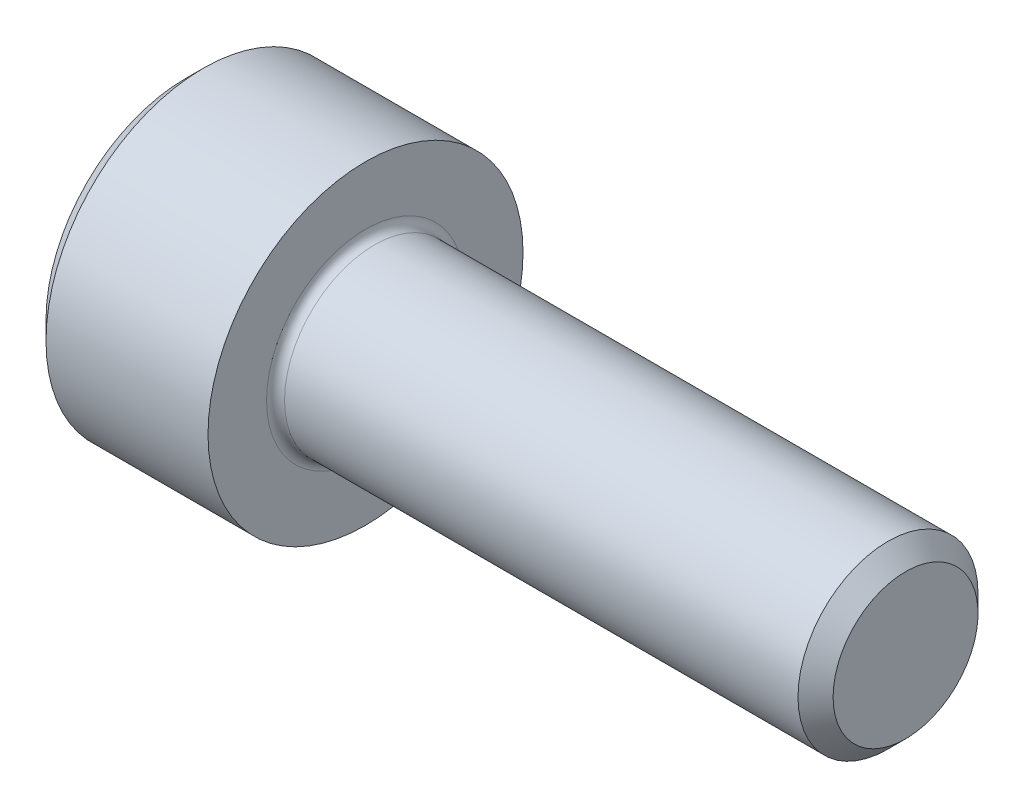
SolidWorks part; units mm, degrees
ref_plane "Plane1" through (0, 0, 0) normal (0, 0, 1) x (1, 0, 0)
ref_plane "Plane2" through (0, 0, 0) normal (0, 1, 0) x (1, 0, 0)
ref_plane "Plane3" through (0, 0, 0) normal (1, 0, 0) x (0, 0, -1)
sketch "BodySke" plane through (0, 0, 0) normal (0, 0, 1) x (1, 0, 0)
  line L0 (0, 0) -> (0, 3.1)
  line L1 (0.4, 3.5) -> (4, 3.5)
  line L2 (4, 3.5) -> (4, 2)
  line L3 (4, 2) -> (15.61, 2)
  line L4 (16, 1.61) -> (16, 0)
  line L5 (16, 0) -> (0, 0)
  line L6 (-31.75, 0) -> (127, 0) construction
  line L7 (0, 3.1) -> (0.4, 3.5)
  line L8 (16, 1.61) -> (15.61, 2)
  line L9 (0, -3.1) -> (0.4, -3.5) construction
  line L10 (16, -1.61) -> (15.61, -2) construction
  line L11 (4.7, 9.525) -> (4.7, 3.175) construction
  line L12 (4, 9.525) -> (4, 3.175) construction
  line L13 (-34, 9.525) -> (-34, 3.175) construction
  dimension "Diameter" = 4
  dimension "Head_ht" = 4
  dimension "Length" = 12
  dimension "Body_ch_ang" = 45
  dimension "Head_dia" = 7
  dimension "Head_ch_ang" = 45
  dimension "Minor_dia" = 3.22
  dimension "Advance" = 0.7
  dimension "Thread_nom" = 12
  dimension "Thread_length" = 50
  dimension "Head_ch_ht" = 0.4
revolve "Base-Revolve" add sketch "BodySke"
fillet "Fillet1" radius 0.2 1 edges at (4, 0, 2)
sketch "Sketch2" plane through (0, 0, 0) normal (0, 0, 1) x (1, 0, 0)
  line L0 (0, 1.5355) -> (2, 1.5355)
  line L1 (2, 1.5355) -> (2.8865, 0)
  line L2 (-31.75, 0) -> (127, 0) construction
  line L3 (2.8865, 0) -> (0, 0)
  line L4 (0, 0) -> (0, 1.5355)
  line L5 (0, 3.1) -> (0, -3.1) construction
  line L6 (0, 0) -> (47.625, 0) construction
  line L7 (4, -3.5) -> (4, 3.5) construction
  dimension "D1" = 1.5355
  dimension "D2" = 60
  dimension "Wall_thickness" = 2
revolve "Hex-PreBroach" cut sketch "Sketch2" angle 360 about L6
sketch "Sketch3" plane through (0, 0, 0) normal (-1, 0, 0) x (0, 0.5, 0.866)
  line L0 (0.8865, 1.5355) -> (-0.8865, 1.5355)
  line L1 (-0.8865, 1.5355) -> (-1.773, 0)
  line L2 (0.8865, 1.5355) -> (1.773, 0)
  line L3 (0.8865, -1.5355) -> (1.773, 0)
  line L4 (0.8865, -1.5355) -> (-0.8865, -1.5355)
  line L5 (-0.8865, -1.5355) -> (-1.773, 0)
  dimension "D1" = 1.5355
  dimension "D2" = 1.5355
  dimension "Hex_size" = 3.071
extrude "Hex" cut sketch "Sketch3" against normal blind 2
sketch "Sketch4" plane through (0, 0, 0) normal (-1, 0, 0) x (0, 0, 1)
  line L0 (0, 0) -> (1.7399, 0)
  line L1 (0, 0) -> (6.1484, 3.5498) construction
  line L2 (0, 0) -> (0.8699, 1.5068)
  line L3 (1.4457, 0.3947) -> (1.6607, 0.5189)
  line L4 (1.0647, 1.0546) -> (1.2797, 1.1788)
  arc A0 (1.4457, 0.3947) -> (1.0647, 1.0546) centre (0, 0) ccw
  arc A1 (1.7399, 0) -> (1.6607, 0.5189) centre (0, 0) ccw
  arc A2 (0.8699, 1.5068) -> (1.2797, 1.1788) centre (0, 0) cw
  dimension "D1" = 30
  dimension "Spline_n_dim" = 2.9972
  dimension "Spline_m_dim" = 3.4798
  dimension "D2" = 60
  dimension "D3" = 0.381
  dimension "Spline_p_dim" = 0.762
extrude "Spline" [suppressed] cut sketch "Sketch4" against normal blind 2
pattern_circular "CirPattern1" [suppressed] count 6 every 60
sketch "Sketch5" plane through (0, 0, 0) normal (0, 0, 1) x (1, 0, 0)
  line L0 (-31.75, 0) -> (127, 0) construction
  line L2 (0, 3.1) -> (0, -3.1) construction
  circle A0 centre (1.6, 0) radius 0.675
  dimension "Drilled_hole_dia" = 1.35
  dimension "Drilled_hole_loc" = 1.6
extrude "Hole" [suppressed] cut sketch "Sketch5" against normal through all and the other way through all
pattern_circular "Drilled-4" [suppressed] count 2 every 60
pattern_circular "Drilled-6" [suppressed] count 3 every 60
sketch "ThdSchSke" plane through (0, 0, 0) normal (0, 0, 1) x (1, 0, 0)
  line L0 (4.7, -1.61) -> (4.4269, -2)
  line L1 (4.7, -1.61) -> (4.9731, -2)
  line L2 (4.9731, -2) -> (4.9731, -2.5)
  line L3 (-3.175, 0) -> (5.1513, 0) construction
  line L5 (4.9731, -2.5) -> (4.4269, -2.5)
  line L6 (4.4269, -2.5) -> (4.4269, -2)
  line L7 (0, 3.1) -> (0, -3.1) construction
  dimension "Thread_minor" = 3.22
  dimension "Diameter" = 4
  dimension "Start" = 4.7
  dimension "SideAngle" = 55
  dimension "VeeAngle" = 70
  dimension "Overcut" = 5
revolve "ThreadSchematic" [suppressed] cut sketch "ThdSchSke" angle 360 about L3
pattern_linear "ThdSchPat" [suppressed]
equation "\"D2@Sketch3\" = \"Hex_size@Sketch3\" / 2"
equation "\"D1@Sketch3\" = \"Hex_size@Sketch3\" / 2"
equation "\"D1@Sketch2\" = \"Hex_size@Sketch3\" / 2"
equation "\"D3@Sketch4\" = \"Spline_p_dim@Sketch4\" / 2"
equation "\"Thread_minor@ThreadCosmetic\"  =  \"Minor_dia@BodySke\""
equation "\"D2@CirPattern1\" = 360 / \"Num_teeth@CirPattern1\""
equation "\"Wall_thickness@Sketch2\" = \"Head_ht@BodySke\" - \"Key_eng@Hex\""
equation "\"Thread_length@ThreadCosmetic\" = ((sgn( (\"Length@BodySke\" - \"Advance@BodySke\" ) - \"Thread_nom@BodySke\" )-1)*( (\"Length@BodySke\" - \"Advance@BodySke\" ) - \"Thread_nom@BodySke\" ))/-2+ \"Thread_nom@BodySke\""
equation "\"Thread_minor@ThdSchSke\" = \"Minor_dia@BodySke\""
equation "\"Diameter@ThdSchSke\" = \"Diameter@BodySke\""
equation "\"Overcut@ThdSchSke\" = \"Diameter@BodySke\" * 1.25"
equation "\"Start@ThdSchSke\" = \"Head_ht@BodySke\" + \"Length@BodySke\" - \"Thread_length@ThreadCosmetic\"  '---Non-countersunk---"
equation "\"Num_threads@ThdSchPat\" = int( \"Thread_length@ThreadCosmetic\" / \"Advance@BodySke\" + 0.999 )  + 1"
equation "\"Advance@ThdSchPat\" = \"Thread_length@ThreadCosmetic\" /  (\"Num_threads@ThdSchPat\" - 1) 'relax it"
equation "\"Num_threads@ThdSchPat\" = \"Num_threads@ThdSchPat\" - sgn( \"Num_threads@ThdSchPat\" - 1) '---chamfered tips only---"
